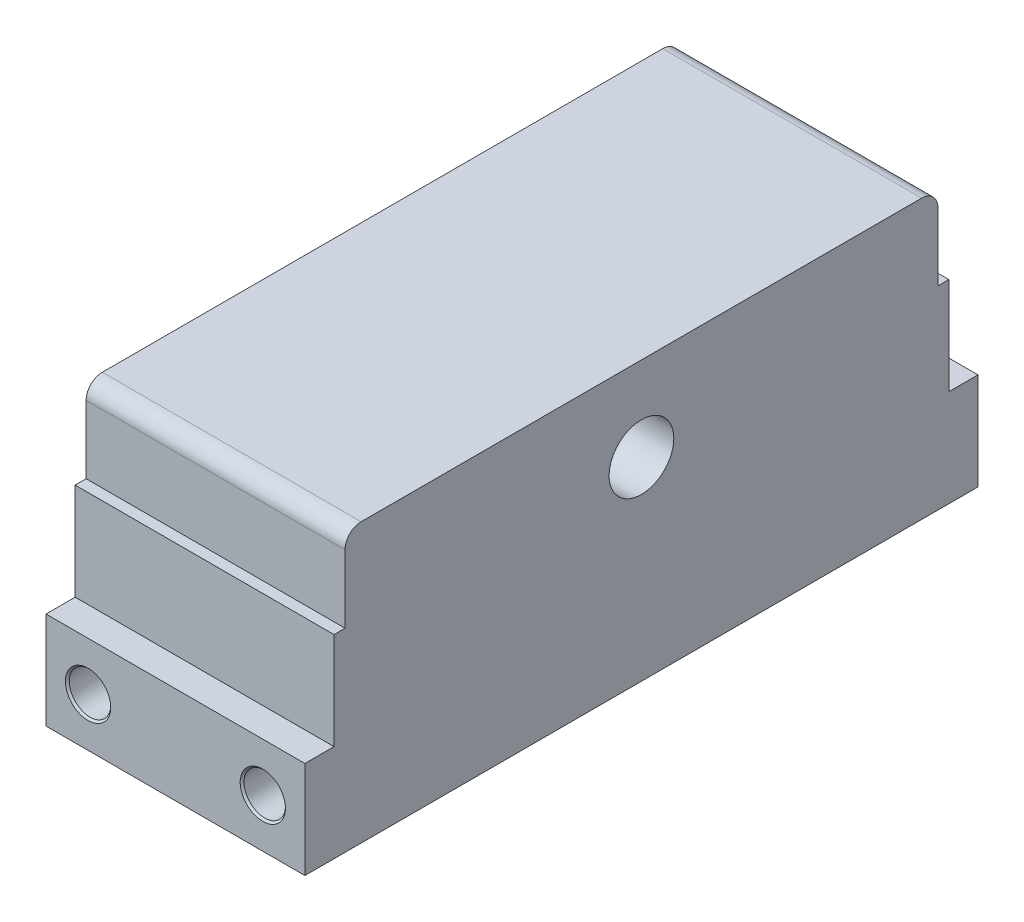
SolidWorks part; units mm, degrees
ref_plane "Piano frontale" through (0, 0, 0) normal (0, 0, 1) x (1, 0, 0)
ref_plane "Piano superiore" through (0, 0, 0) normal (0, 1, 0) x (1, 0, 0)
ref_plane "Piano destro" through (0, 0, 0) normal (1, 0, 0) x (0, 0, -1)
sketch "Schizzo1" plane through (0, 0, 0) normal (1, 0, 0) x (0, 0, -1)
  line L0 (0, -25.5031) -> (0, -45.4428) construction
  line L1 (-45.8, 10.5) -> (-45.8, 0)
  line L2 (-45.8, 0) -> (-47.5, 0)
  line L3 (-47.5, 0) -> (-47.5, -15)
  line L4 (-47.5, -15) -> (-52, -15)
  line L5 (-52, -15) -> (-52, -30)
  line L6 (-52, -30) -> (52, -30)
  line L7 (52, -30) -> (52, -15)
  line L8 (52, -15) -> (47.5, -15)
  line L9 (47.5, -15) -> (47.5, 0)
  line L10 (47.5, 0) -> (45.8, 0)
  line L11 (45.8, 0) -> (45.8, 10.5)
  line L12 (43.3, 13) -> (0, 13)
  line L13 (0, 55) -> (0, -55) construction
  line L14 (0, 13) -> (-43.3, 13)
  arc A0 (-43.3, 13) -> (-45.8, 10.5) centre (-43.3, 10.5) ccw
  arc A1 (43.3, 13) -> (45.8, 10.5) centre (43.3, 10.5) cw
  circle A2 centre (0, 0) radius 5
  point P16 (0, -30)
  dimension "D1" = 104
  dimension "D2" = 15
  dimension "D3" = 4.5
  dimension "D4" = 4.5
  dimension "D5" = 43.3
  dimension "D6" = 43.3
  dimension "D7" = 1.7
  dimension "D8" = 1.7
extrude "Estrusione-Estrusione1" add sketch "Schizzo1" along normal blind 40
sketch "Schizzo2" plane through (0, 0, 52) normal (0, 0, 1) x (1, 0, 0)
  line L0 (0, -15) -> (0, -30) construction
  line L3 (40, -15) -> (40, -30) construction
  line L4 (40, -30) -> (0, -30) construction
  point P0 (6.5, -22.5)
  point P6 (33.5, -22.5)
  dimension "D1" = 6.5
  dimension "D2" = 7.5
  dimension "D3" = 6.5
  dimension "D4" = 7.5
hole_wizard "Foro per Vite M6-1" positions "Schizzo3D1" profile "Schizzo3" hole size "M6" standard "ISO"
sketch3d "Schizzo3D1"
  point P0 (6.5, -22.5, 52)
  point P3 (33.5, -22.5, 52)
sketch "Schizzo3" plane through (6.5, -22.5, 52) normal (1, 0, 0) x (0, -1, 0)
  line L0 (0, 0) -> (0, 31.9228)
  line L1 (0, 31.9228) -> (3.2, 30)
  line L2 (3.2, 30) -> (3.2, 0.3)
  line L3 (3.2, 0.3) -> (3.5, 0)
  line L5 (3.5, 0) -> (0, 0)
  line L6 (-3.2, 0.3) -> (-3.5, 0) construction
  line L10 (0, 31.9228) -> (-3.2, 30) construction
  line L11 (0, -6.35) -> (0, 107.95) construction
  dimension "Hole Dia." = 6.4
  dimension "Hole Depth" = 30
  dimension "Near C'Sink Dia." = 7
  dimension "Near C'Sink Angle" = 90
  dimension "Drill Angle" = 118
hole_wizard "Foro per Vite M6-2" positions "Schizzo5" profile "Schizzo4" hole size "M6" standard "ISO"
sketch "Schizzo5" plane through (0, 0, -52) normal (0, 0, -1) x (-1, 0, 0)
  point P0 (-33.5, -22.5)
sketch "Schizzo4" plane through (33.5, -22.5, -52) normal (1, 0, 0) x (0, 1, 0)
  line L0 (0, 0) -> (0, 31.9228)
  line L1 (0, 31.9228) -> (3.2, 30)
  line L2 (3.2, 30) -> (3.2, 0.3)
  line L3 (3.2, 0.3) -> (3.5, 0)
  line L5 (3.5, 0) -> (0, 0)
  line L6 (-3.2, 0.3) -> (-3.5, 0) construction
  line L10 (0, 31.9228) -> (-3.2, 30) construction
  line L11 (0, -6.35) -> (0, 107.95) construction
  dimension "Hole Dia." = 6.4
  dimension "Hole Depth" = 30
  dimension "Near C'Sink Dia." = 7
  dimension "Near C'Sink Angle" = 90
  dimension "Drill Angle" = 118
hole_wizard "Foro per Vite M6-5" positions "Schizzo9" profile "Schizzo8" hole size "M6" standard "ISO"
sketch "Schizzo9" plane through (0, 0, -52) normal (0, 0, -1) x (-1, 0, 0)
  point P0 (-6.5, -22.5)
sketch "Schizzo8" plane through (6.5, -22.5, -52) normal (1, 0, 0) x (0, 1, 0)
  line L0 (0, 0) -> (0, 31.9228)
  line L1 (0, 31.9228) -> (3.2, 30)
  line L2 (3.2, 30) -> (3.2, 0.3)
  line L3 (3.2, 0.3) -> (3.5, 0)
  line L5 (3.5, 0) -> (0, 0)
  line L6 (-3.2, 0.3) -> (-3.5, 0) construction
  line L10 (0, 31.9228) -> (-3.2, 30) construction
  line L11 (0, -6.35) -> (0, 107.95) construction
  dimension "Hole Dia." = 6.4
  dimension "Hole Depth" = 30
  dimension "Near C'Sink Dia." = 7
  dimension "Near C'Sink Angle" = 90
  dimension "Drill Angle" = 118
